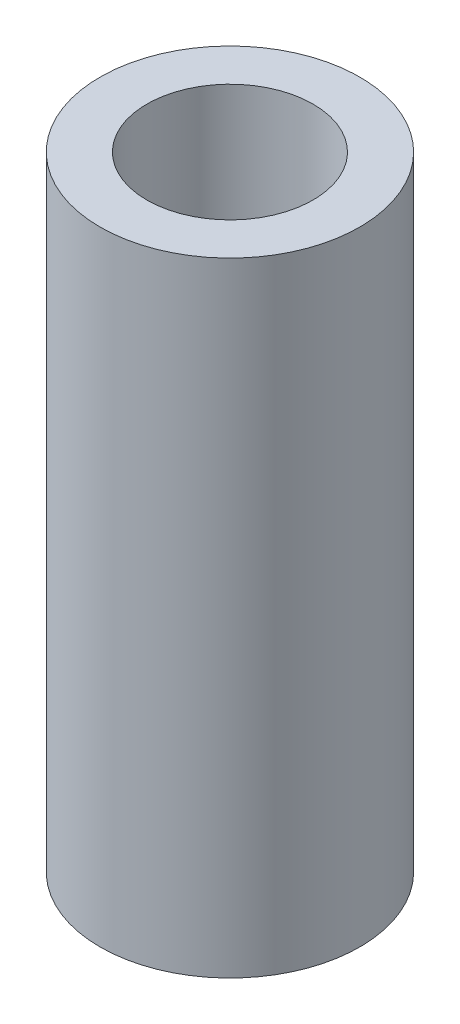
SolidWorks part; units mm, degrees
ref_plane "Front" through (0, 0, 0) normal (0, 0, 1) x (1, 0, 0)
ref_plane "Top" through (0, 0, 0) normal (0, 1, 0) x (1, 0, 0)
ref_plane "Right" through (0, 0, 0) normal (1, 0, 0) x (0, 0, -1)
sketch "Sketch1" plane through (0, 0, 0) normal (0, 1, 0) x (1, 0, 0)
  line L1 (2.8868, 0) -> (1.4434, 2.5) construction
  line L2 (1.4434, 2.5) -> (-1.4434, 2.5) construction
  line L3 (-1.4434, 2.5) -> (-2.8868, 0) construction
  line L4 (-2.8868, 0) -> (-1.4434, -2.5) construction
  line L5 (-1.4434, -2.5) -> (1.4434, -2.5) construction
  line L6 (1.4434, -2.5) -> (2.8868, 0) construction
  circle A0 centre (0, 0) radius 2.5
  dimension "D1" = 5
extrude "Boss-Extrude1" add sketch "Sketch1" along normal blind 12
hole_wizard "Ø3.2 (3.2) Diameter Hole1" positions "Sketch3" profile "Sketch2" hole size "Ø3.2" standard "ANSI Metric"
sketch "Sketch3" plane through (0, 12, 0) normal (0, 1, 0) x (-1, 0, 0)
  point P0 (0, 0)
sketch "Sketch2" plane through (0, 12, 0) normal (1, 0, 0) x (0, 0, 1)
  line L0 (0, 0) -> (0, 12)
  line L1 (0, 12) -> (1.6, 12)
  line L2 (1.6, 12) -> (1.6, 0)
  line L5 (1.6, 0) -> (0, 0)
  line L11 (0, -6.35) -> (0, 107.95) construction
  dimension "Thru Hole Dia." = 3.2
  dimension "Thru Hole Depth" = 12
equation "\"Buoyancy\"=\"SW-Volume\"*(\"SW-Density\"-.037062)"
